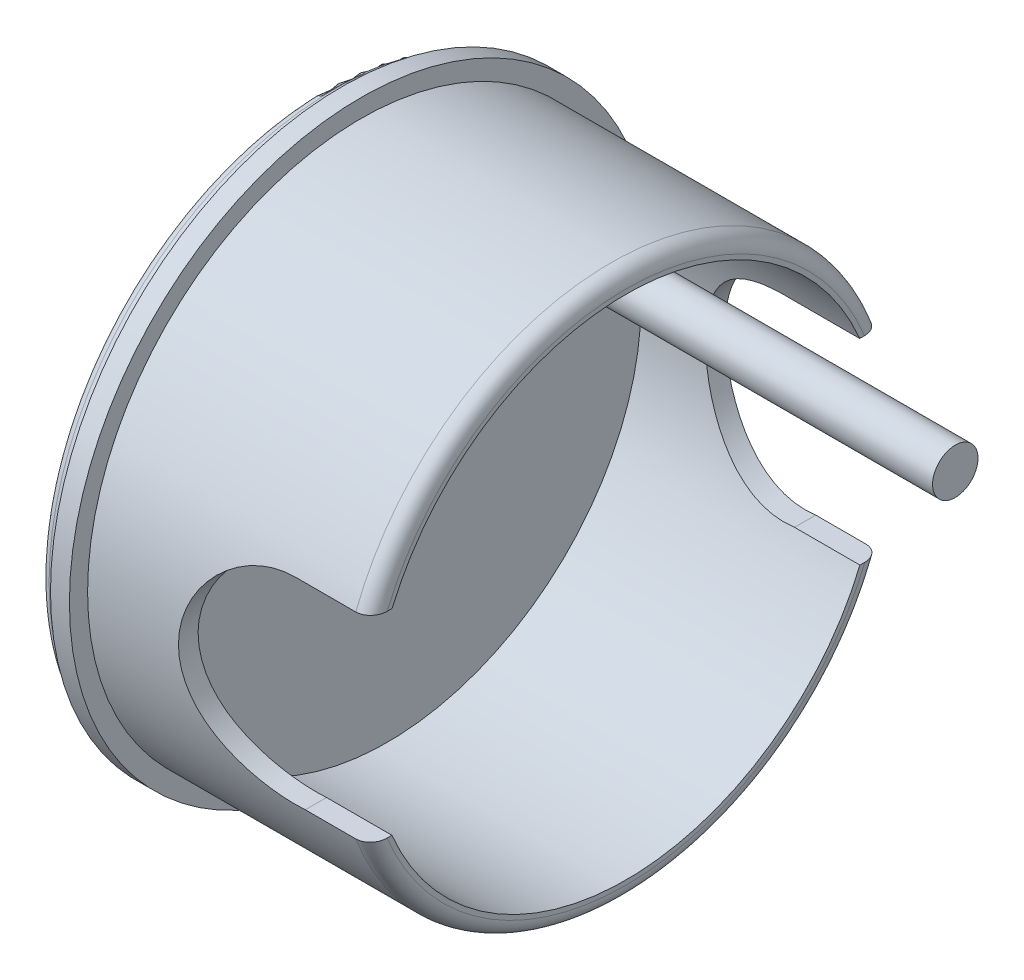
SolidWorks part; units mm, degrees
ref_plane "Plan1" through (0, 0, 0) normal (0, 0, 1) x (1, 0, 0)
ref_plane "Plan2" through (0, 0, 0) normal (0, 1, 0) x (1, 0, 0)
ref_plane "Plan3" through (0, 0, 0) normal (1, 0, 0) x (0, 0, -1)
sketch "Esquisse1" plane through (0, 0, 0) normal (0, 0, 1) x (1, 0, 0)
  line L0 (8, 0) -> (20, 0)
  line L1 (12, 37.5) -> (14, 37.5)
  line L2 (14, 37.5) -> (14, 38.5)
  line L3 (14, 38.5) -> (16.5, 38.5)
  line L4 (16.5, 38.5) -> (16.5, 36.1)
  line L5 (20, 0) -> (20, 33.5)
  line L6 (16.5, 36.1) -> (51.5, 36.1)
  line L7 (51.5, 36.1) -> (51.5, 33.5)
  line L8 (20, 33.5) -> (51.5, 33.5)
  line L9 (-10, 0) -> (66, 0) construction
  arc A0 (8, 0) -> (12, 37.5) centre (200.1539, -1.5331) cw
  dimension "D1" = 36.1
  dimension "D3" = 37.5
  dimension "D2" = 33.5
  dimension "D4" = 2.5
  dimension "D5" = 2
  dimension "D6" = 38.5
  dimension "D7" = 35
revolve "Base-Révolution" add sketch "Esquisse1" angle 360 about L9
sketch "Esquisse3" plane through (0, 0, 0) normal (0, 0, 1) x (1, 0, 0)
  line L0 (41.5, 13) -> (66.8646, 13)
  line L1 (42.8646, -12.9282) -> (66.8646, -12.9282)
  line L2 (66.8646, 13) -> (66.8646, -12.9282)
  line L3 (51.5, -36.1) -> (51.5, 36.1) construction
  arc A0 (41.5, 13) -> (42.8646, -12.9282) centre (41.5, 0) ccw
  dimension "D2" = 13
  dimension "D1" = 10
extrude "Enlèv. mat.-Extru.1" cut sketch "Esquisse3" against normal mid plane 200
sketch "Esquisse4" plane through (0, 0, 0) normal (1, 0, 0) x (0, 0, -1)
  line L0 (-17.5, 10) -> (17.5, 10)
  line L1 (17.5, 10) -> (17.5, -20)
  line L2 (17.5, -20) -> (-17.5, -20)
  line L3 (-17.5, -20) -> (-17.5, 10)
  dimension "D1" = 30
  dimension "D2" = 35
  dimension "D3" = 20
  dimension "D4" = 17.5
extrude "Enlèv. mat.-Extru.2" cut sketch "Esquisse4" along normal blind 13
sketch "Esquisse5" plane through (20, 0, 0) normal (1, 0, 0) x (0, 0, -1)
  circle A0 centre (10, 25) radius 3
  dimension "D1" = 6
extrude "Boss.-Extru.1" add sketch "Esquisse5" along normal blind 65
fillet "Congé1" radius 2
fillet "Congé2" radius 5
fillet "Congé3" radius 1
fillet "Congé4" radius 1
